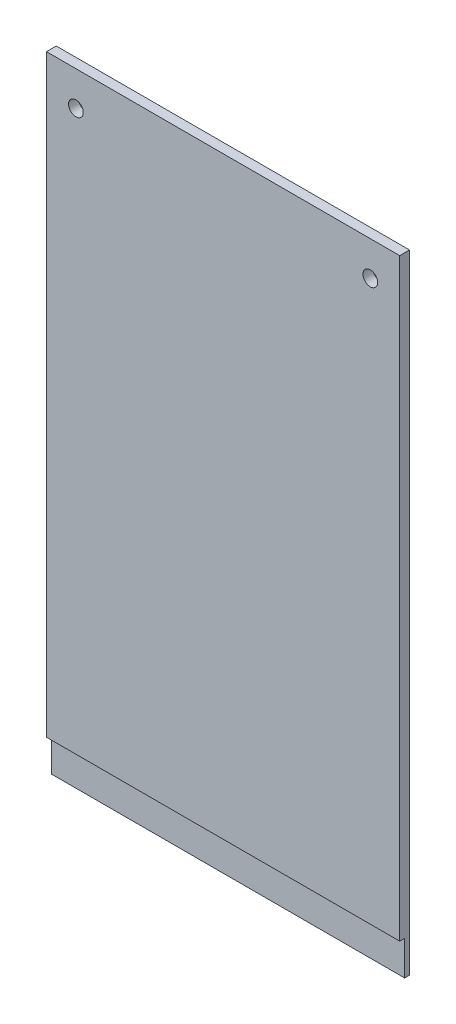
SolidWorks part; units mm, degrees
ref_plane "Front Plane" through (0, 0, 0) normal (0, 0, 1) x (1, 0, 0)
ref_plane "Top Plane" through (0, 0, 0) normal (0, 1, 0) x (1, 0, 0)
ref_plane "Right Plane" through (0, 0, 0) normal (1, 0, 0) x (0, 0, -1)
sketch "Sketch2" plane through (0, 0, 0) normal (0, 0, 1) x (1, 0, 0)
  line L1 (-36, 124.5) -> (36, 124.5)
  line L2 (-36, 124.5) -> (-36, -124.5)
  line L3 (-36, -124.5) -> (36, -124.5)
  line L4 (36, 124.5) -> (36, -124.5)
  line L5 (-36, 124.5) -> (36, -124.5) construction
  line L6 (-36, -124.5) -> (36, 124.5) construction
  point P0 (0, 0)
  dimension "D1" = 249
  dimension "D2" = 72
extrude "Boss-Extrude1" add sketch "Sketch2" along normal blind 2
sketch "Sketch3" plane through (0, 0, 2) normal (0, 0, 1) x (1, 0, 0)
  line L0 (86.8288, 116.5) -> (-86.8288, 116.5) construction
  line L1 (-92.684, -116.5) -> (92.684, -116.5) construction
  line L2 (36, 124.5) -> (-36, 124.5) construction
  line L3 (36, -124.5) -> (36, 124.5) construction
  line L4 (-36, 124.5) -> (-36, -124.5) construction
  circle A0 centre (30, 116.5) radius 1.5
  circle A1 centre (-30, 116.5) radius 1.5
  circle A2 centre (30, -116.5) radius 1.5
  circle A3 centre (-30, -116.5) radius 1.5
  point P3 (0, 116.5)
  point P6 (0, -116.5)
  dimension "D3" = 3
  dimension "D6" = 6
  dimension "D1" = 8
  dimension "D2" = 8
  dimension "D4" = 6
  dimension "D5" = 6
  dimension "D7" = 6
extrude "Cut-Extrude1" cut sketch "Sketch3" against normal through all
sketch "Sketch4" plane through (36, 0, 0) normal (1, 0, 0) x (0, 0, -1)
  line L4 (-1, -3) -> (-1, 2.5)
  line L5 (-1, 2.5) -> (-2, 2.5)
  line L7 (-2, -124.5) -> (-2, 124.5) construction
  line L8 (-1, -3) -> (-2, -3)
  line L9 (-2, -3) -> (-2, 2.5)
  point P0 (0, 0)
  dimension "D2" = 5.5
sketch "Sketch5" plane through (0, 0, 2) normal (0, 0, 1) x (1, 0, 0)
  line L0 (-36, -124.5) -> (-36, -4.5)
  line L1 (-36, 124.5) -> (-36, -124.5) construction
  line L2 (-36, -4.5) -> (36, -4.5)
  line L3 (36, -124.5) -> (36, 124.5) construction
  line L4 (36, -4.5) -> (36, -124.5)
  line L5 (36, -124.5) -> (-36, -124.5)
  line L6 (36, -3) -> (36, 2.5) construction
  dimension "D1" = 120
extrude "Cut-Extrude2" cut sketch "Sketch5" against normal through all
extrude "Cut-Extrude3" cut sketch "Sketch4" against normal through all
sketch "Sketch6" plane through (36, 0, 0) normal (1, 0, 0) x (0, 0, -1)
  line L0 (-1, -3) -> (-1, -4.5)
  line L1 (0, -4.5) -> (-2, -4.5) construction
  line L2 (-1, -4.5) -> (-2, -4.5)
  line L3 (-2, -4.5) -> (-2, -3)
  line L4 (-2, -3) -> (-1, -3)
extrude "Cut-Extrude4" cut sketch "Sketch6" against normal through all
sketch "Sketch8" plane through (36, 0, 0) normal (1, 0, 0) x (0, 0, -1)
  line L0 (0, 124.5) -> (-2, 124.5)
  line L1 (-2, 124.5) -> (-2, 123.5)
  line L2 (-2, 2.5) -> (-2, 124.5) construction
  line L3 (-2, 123.5) -> (0, 123.5)
  line L4 (0, -4.5) -> (0, 124.5) construction
  line L5 (0, 123.5) -> (0, 124.5)
  dimension "D1" = 1
extrude "Cut-Extrude5" cut sketch "Sketch8" against normal through all
